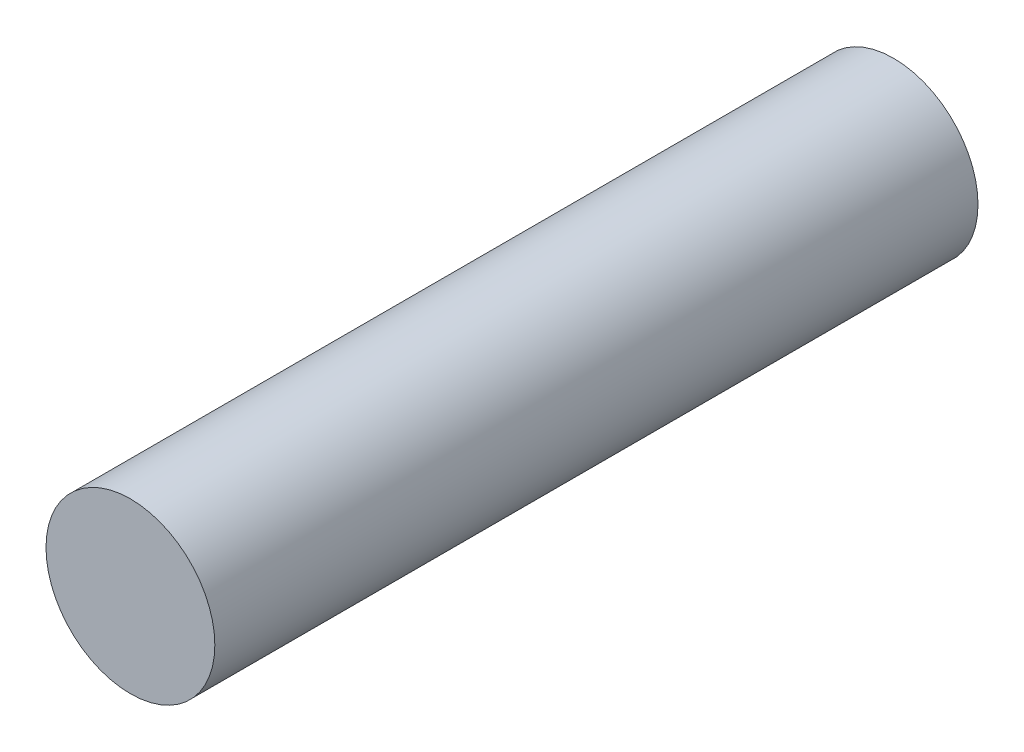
SolidWorks part; units mm, degrees
ref_plane "Front Plane" through (0, 0, 0) normal (0, 0, 1) x (1, 0, 0)
ref_plane "Top Plane" through (0, 0, 0) normal (0, 1, 0) x (1, 0, 0)
ref_plane "Right Plane" through (0, 0, 0) normal (1, 0, 0) x (0, 0, -1)
sketch "Sketch1" plane through (0, 0, 0) normal (0, 0, 1) x (1, 0, 0)
  circle A0 centre (0, 0) radius 9.525
  dimension "D1" = 19.05
extrude "Extrude1" add sketch "Sketch1" along normal blind 86.106
